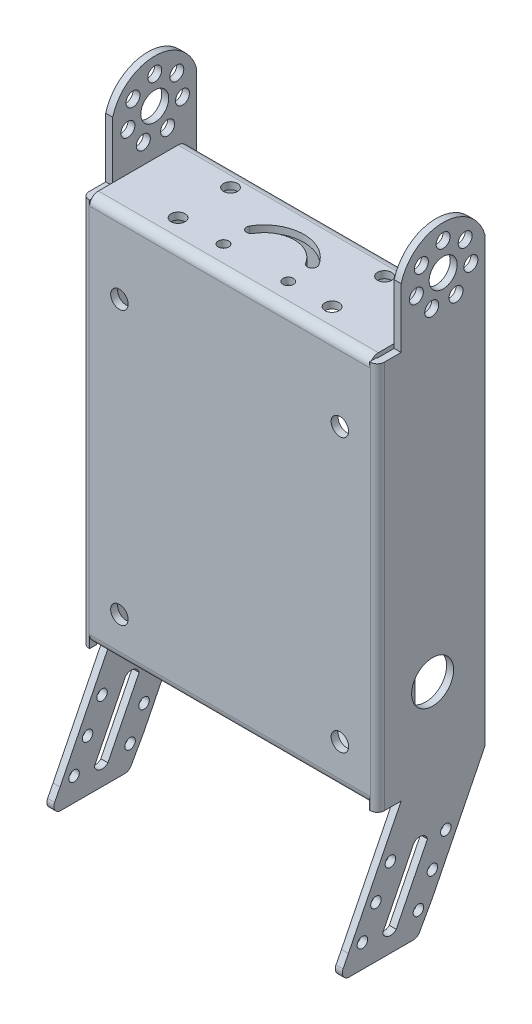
SolidWorks part; units mm, degrees
ref_plane "Plan de face" through (0, 0, 0) normal (0, 0, 1) x (1, 0, 0)
ref_plane "Plan de dessus" through (0, 0, 0) normal (0, 1, 0) x (1, 0, 0)
ref_plane "Plan de droite" through (0, 0, 0) normal (1, 0, 0) x (0, 0, -1)
imported_body "Importée3"
sketch "Esquisse1" plane through (43.375, 0, 0) normal (1, 0, 0) x (0, 0, -1)
  line L0 (6.8004, 103.2822) -> (6.8004, 120.2822)
  line L1 (30.8004, 120.2822) -> (30.8004, -6)
  line L2 (30.8004, -6) -> (15.7419, -36.2027)
  line L3 (15.7419, -36.2027) -> (11.4766, -43.8624)
  line L4 (11.4766, -43.8624) -> (-8.0211, -43.8624)
  line L5 (-9.8033, -40.9548) -> (6.8004, -8.3508)
  line L6 (6.8004, -8.3508) -> (6.8004, -7.7178)
  line L7 (6.8004, -7.7178) -> (0, -7.7178)
  line L8 (0, -7.7178) -> (0, 103.2822)
  line L9 (0, 103.2822) -> (6.8004, 103.2822)
  arc A0 (6.8004, 120.2822) -> (30.8004, 120.2822) centre (18.8004, 117.0095) cw
  arc A1 (-8.0211, -43.8624) -> (-9.8033, -40.9548) centre (-8.0211, -41.8624) cw
extrude "Boss.-Extru.1" add sketch "Esquisse1" along normal blind 2.2
sketch "Esquisse2" plane through (-36.625, 0, 0) normal (-1, 0, 0) x (0, 0, 1)
  line L0 (0, 101.7822) -> (0, 103.2822)
  line L1 (0, 103.2822) -> (-0.5, 103.2822)
  arc A0 (-0.5, 103.2822) -> (0, 101.7822) centre (-2.5, 101.7822) cw
extrude "Enlèv. mat.-Extru.1" cut sketch "Esquisse2" against normal blind 80
sketch "Esquisse3" plane through (43.375, 0, 0) normal (-1, 0, 0) x (0, 0, 1)
  line L0 (-6.8004, -7.7178) -> (-2, -7.7178)
  line L1 (-2, -7.7178) -> (-2, 103.2822)
  line L2 (-2, 103.2822) -> (-6.8004, 103.2822)
  line L3 (-6.8004, 103.2822) -> (-6.8004, 120.2822)
  line L4 (-30.8004, 120.2822) -> (-30.8004, -6)
  line L5 (-30.8004, -6) -> (-15.7419, -36.2027)
  line L6 (-15.7419, -36.2027) -> (-11.4766, -43.8624)
  line L7 (-11.4766, -43.8624) -> (8.0211, -43.8624)
  line L8 (9.8033, -40.9548) -> (-6.8004, -8.3508)
  line L9 (-6.8004, -8.3508) -> (-6.8004, -7.7178)
  arc A0 (-6.8004, 120.2822) -> (-30.8004, 120.2822) centre (-18.8004, 117.0095) ccw
  arc A1 (8.0211, -43.8624) -> (9.8033, -40.9548) centre (8.0211, -41.8624) ccw
extrude "Enlèv. mat.-Extru.2" cut sketch "Esquisse3" against normal blind 0.2
sketch "Esquisse4" plane through (-36.625, 0, 0) normal (-1, 0, 0) x (0, 0, 1)
  line L0 (-2, -7.7178) -> (-2, 103.2822)
  line L1 (-2, 103.2822) -> (0, 103.2822)
  line L2 (0, 103.2822) -> (0, -7.7178)
  line L3 (0, -7.7178) -> (-2, -7.7178)
extrude "Boss.-Extru.2" add sketch "Esquisse4" along normal blind 0.2
sketch "Esquisse5" plane through (-36.825, 0, 0) normal (-1, 0, 0) x (0, 0, 1)
  line L0 (-6.8004, -8.3508) -> (9.8033, -40.9548)
  line L1 (8.0211, -43.8624) -> (-11.4766, -43.8624)
  line L2 (-11.4766, -43.8624) -> (-15.7419, -36.2027)
  line L3 (-15.7419, -36.2027) -> (-30.8004, -6)
  line L4 (-30.8004, -6) -> (-30.8004, 120.2822)
  line L5 (-6.8004, 120.2822) -> (-6.8004, 103.2822)
  line L6 (-6.8004, 103.2822) -> (0, 103.2822)
  line L7 (0, 103.2822) -> (0, -7.7178)
  line L8 (0, -7.7178) -> (-6.8004, -7.7178)
  line L9 (-6.8004, -7.7178) -> (-6.8004, -8.3508)
  arc A0 (9.8033, -40.9548) -> (8.0211, -43.8624) centre (8.0211, -41.8624) cw
  arc A1 (-30.8004, 120.2822) -> (-6.8004, 120.2822) centre (-18.8004, 117.0095) cw
extrude "Boss.-Extru.3" add sketch "Esquisse5" along normal blind 2
sketch "Esquisse6" plane through (0, 0, -24.5) normal (0, 0, -1) x (-1, 0, 0)
  line L0 (21.625, -4.7178) -> (21.625, -6.7178)
  line L1 (21.625, -6.7178) -> (-28.375, -6.7178)
  line L2 (-28.375, -6.7178) -> (-28.375, -4.7178)
  line L3 (-28.375, -4.7178) -> (21.625, -4.7178)
extrude "Boss.-Extru.4" add sketch "Esquisse6" along normal blind 3.5
sketch "Esquisse7" plane through (0, -4.7178, 0) normal (0, 1, 0) x (-1, 0, 0)
  line L0 (-28.375, -26) -> (21.625, -26)
  line L1 (21.625, -26) -> (21.625, -28)
  line L2 (21.625, -28) -> (-28.375, -28)
  line L3 (-28.375, -28) -> (-28.375, -26)
extrude "Boss.-Extru.5" add sketch "Esquisse7" along normal blind 13
sketch "Esquisse8" plane through (0, 102.2822, 0) normal (0, -1, 0) x (1, 0, 0)
  line L0 (-36.625, -26) -> (43.375, -26)
  line L1 (43.375, -26) -> (43.375, -28)
  line L2 (43.375, -28) -> (-36.625, -28)
  line L3 (-36.625, -28) -> (-36.625, -26)
extrude "Boss.-Extru.6" add sketch "Esquisse8" along normal blind 13
sketch "Esquisse9" plane through (43.575, 0, 0) normal (-1, 0, 0) x (0, 0, 1)
  line L0 (-14.3311, -20.8593) -> (-5.4071, -38.758)
  line L1 (-1.526, -37.7903) -> (-10.4499, -19.8916)
  arc A0 (-5.4071, -38.758) -> (-1.526, -37.7903) centre (-3.7419, -37.1698) ccw
  arc A1 (-10.4499, -19.8916) -> (-14.3311, -20.8593) centre (-12.1152, -21.4799) ccw
extrude "Enlèv. mat.-Extru.3" cut sketch "Esquisse9" against normal through all
sketch "Esquisse10" plane through (0, 102.2822, 0) normal (0, -1, 0) x (1, 0, 0)
  arc A0 (-6.3635, -15.468) -> (13.187, -15.6386) centre (3.4623, -9.7638) ccw
  arc A1 (13.187, -15.6386) -> (10.8563, -14.2306) centre (12.0216, -14.9346) ccw
  arc A2 (10.8563, -14.2306) -> (-4.0086, -14.1008) centre (3.4623, -9.7638) cw
  arc A3 (-4.0086, -14.1008) -> (-6.3635, -15.468) centre (-5.1861, -14.7844) ccw
extrude "Enlèv. mat.-Extru.4" cut sketch "Esquisse10" against normal through all
sketch "Esquisse11" plane through (-36.825, 0, 0) normal (1, 0, 0) x (0, 0, -1)
  line L0 (5.4071, -38.758) -> (14.3311, -20.8593)
  line L1 (10.4499, -19.8916) -> (1.526, -37.7903)
  arc A0 (14.3311, -20.8593) -> (10.4499, -19.8916) centre (12.1152, -21.4799) ccw
  arc A1 (1.526, -37.7903) -> (5.4071, -38.758) centre (3.7419, -37.1698) ccw
extrude "Enlèv. mat.-Extru.5" cut sketch "Esquisse11" against normal through all
draft "Dépouille1" type of draft neutral plane draft angle 26.5 faces to draft 1 parameters "D1"=26.5
draft "Dépouille2" type of draft neutral plane draft angle 26.5 faces to draft 1 parameters "D1"=26.5
hole_wizard "Diamètre du perçage Ø5.0 (5)1" positions "Esquisse13" profile "Esquisse12" hole size "Ø5.0" standard "Ansi Metric"
sketch "Esquisse13" plane through (0, 0, 0) normal (0, 0, 1) x (1, 0, 0)
  point P0 (34.874, 83)
  point P1 (-28.124, 83)
  point P2 (34.874, 5)
  point P3 (-28.124, 5)
sketch "Esquisse12" plane through (34.874, 83, 0) normal (1, 0, 0) x (0, -1, 0)
  line L0 (0, 0) -> (0, 30.8004)
  line L1 (0, 30.8004) -> (2.5, 30.8004)
  line L2 (2.5, 30.8004) -> (2.5, 0)
  line L5 (2.5, 0) -> (0, 0)
  line L11 (0, -6.35) -> (0, 107.95) construction
  dimension "Diamètre du perçage jusqu'au prochain" = 5
  dimension "Profondeur du perçage jusqu'au prochain" = 30.8004
hole_wizard "Diamètre du perçage Ø8.0 (8)1" positions "Esquisse15" profile "Esquisse14" hole size "Ø8.0" standard "Ansi Metric"
sketch "Esquisse15" plane through (-38.825, 0, 0) normal (-1, 0, 0) x (0, 0, 1)
  point P0 (-18.8004, 117.0095)
sketch "Esquisse14" plane through (-38.825, 117.0095, -18.8004) normal (0, 1, 0) x (0, 0, 1)
  line L0 (0, 0) -> (0, 2)
  line L1 (0, 2) -> (4, 2)
  line L2 (4, 2) -> (4, 0)
  line L5 (4, 0) -> (0, 0)
  line L11 (0, -6.35) -> (0, 107.95) construction
  dimension "Diamètre du perçage jusqu'au prochain" = 8
  dimension "Profondeur du perçage jusqu'au prochain" = 2
hole_wizard "Diamètre du perçage Ø3.0 (3)1" positions "Esquisse17" profile "Esquisse16" hole size "Ø3.0" standard "Ansi Metric"
sketch "Esquisse17" plane through (-38.825, 0, 0) normal (-1, 0, 0) x (0, 0, 1)
  point P0 (-3.7419, -21.1243)
  point P1 (0.3978, -29.1698)
  point P2 (4.2581, -37.1698)
  point P3 (-11.7419, -37.1698)
  point P4 (-15.7419, -29.1698)
  point P5 (-19.5646, -21.1698)
sketch "Esquisse16" plane through (-38.825, -21.1243, -3.7419) normal (0, 1, 0) x (0, 0, 1)
  line L0 (0, 0) -> (0, 2)
  line L1 (0, 2) -> (1.5, 2)
  line L2 (1.5, 2) -> (1.5, 0)
  line L5 (1.5, 0) -> (0, 0)
  line L11 (0, -6.35) -> (0, 107.95) construction
  dimension "Diamètre du perçage jusqu'au prochain" = 3
  dimension "Profondeur du perçage jusqu'au prochain" = 2
hole_wizard "Diamètre du perçage Ø4.0 (4)1" positions "Esquisse19" profile "Esquisse18" hole size "Ø4.0" standard "Ansi Metric"
sketch "Esquisse19" plane through (-38.825, 0, 0) normal (-1, 0, 0) x (0, 0, 1)
  point P0 (-25.0955, 122.0733)
  point P1 (-26.7323, 115.3269)
  point P2 (-22.4782, 109.8409)
  point P3 (-15.5367, 109.7464)
  point P4 (-11.1349, 115.1146)
  point P5 (-12.5874, 121.9031)
  point P6 (-18.8004, 125)
sketch "Esquisse18" plane through (-38.825, 122.0733, -25.0955) normal (0, 1, 0) x (0, 0, 1)
  line L0 (0, 0) -> (0, 2)
  line L1 (0, 2) -> (2, 2)
  line L2 (2, 2) -> (2, 0)
  line L5 (2, 0) -> (0, 0)
  line L11 (0, -6.35) -> (0, 107.95) construction
  dimension "Diamètre du perçage jusqu'au prochain" = 4
  dimension "Profondeur du perçage jusqu'au prochain" = 2
hole_wizard "Diamètre du perçage Ø12.0 (12)1" positions "Esquisse21" profile "Esquisse20" hole size "Ø12.0" standard "Ansi Metric"
sketch "Esquisse21" plane through (-38.825, 0, 0) normal (-1, 0, 0) x (0, 0, 1)
  point P0 (-15.8004, 17.2822)
sketch "Esquisse20" plane through (-38.825, 17.2822, -15.8004) normal (0, 1, 0) x (0, 0, 1)
  line L0 (0, 0) -> (0, 2)
  line L1 (0, 2) -> (6, 2)
  line L2 (6, 2) -> (6, 0)
  line L5 (6, 0) -> (0, 0)
  line L11 (0, -6.35) -> (0, 107.95) construction
  dimension "Diamètre du perçage jusqu'au prochain" = 12
  dimension "Profondeur du perçage jusqu'au prochain" = 2
hole_wizard "Diamètre du perçage Ø4.0 (4)2" positions "Esquisse23" profile "Esquisse22" hole size "Ø4.0" standard "Ansi Metric"
sketch "Esquisse23" plane through (0, 104.2822, 0) normal (0, 1, 0) x (1, 0, 0)
  point P0 (25.375, 22.2634)
  point P1 (-18.625, 22.2634)
  point P2 (25.375, 7.2634)
  point P3 (-18.625, 7.2634)
sketch "Esquisse22" plane through (25.375, 104.2822, -22.2634) normal (1, 0, 0) x (0, 0, 1)
  line L0 (0, 0) -> (0, 2)
  line L1 (0, 2) -> (2, 2)
  line L2 (2, 2) -> (2, 0)
  line L5 (2, 0) -> (0, 0)
  line L11 (0, -6.35) -> (0, 107.95) construction
  dimension "Diamètre du perçage jusqu'au prochain" = 4
  dimension "Profondeur du perçage jusqu'au prochain" = 2
hole_wizard "Diamètre du perçage Ø3.0 (3)2" positions "Esquisse25" profile "Esquisse24" hole size "Ø3.0" standard "Ansi Metric"
sketch "Esquisse25" plane through (0, 104.2822, 0) normal (0, 1, 0) x (1, 0, 0)
  point P0 (12.8604, 7.2634)
  point P1 (-5.6396, 7.2634)
sketch "Esquisse24" plane through (12.8604, 104.2822, -7.2634) normal (1, 0, 0) x (0, 0, 1)
  line L0 (0, 0) -> (0, 2)
  line L1 (0, 2) -> (1.5, 2)
  line L2 (1.5, 2) -> (1.5, 0)
  line L5 (1.5, 0) -> (0, 0)
  line L11 (0, -6.35) -> (0, 107.95) construction
  dimension "Diamètre du perçage jusqu'au prochain" = 3
  dimension "Profondeur du perçage jusqu'au prochain" = 2
hole_wizard "Diamètre du perçage Ø8.0 (8)2" positions "Esquisse27" profile "Esquisse26" hole size "Ø8.0" standard "Ansi Metric"
sketch "Esquisse27" plane through (45.575, 0, 0) normal (1, 0, 0) x (0, 0, -1)
  point P0 (18.8004, 117.0095)
sketch "Esquisse26" plane through (45.575, 117.0095, -18.8004) normal (0, 1, 0) x (0, 0, -1)
  line L0 (0, 0) -> (0, 84.4)
  line L1 (0, 84.4) -> (4, 84.4)
  line L2 (4, 84.4) -> (4, 0)
  line L5 (4, 0) -> (0, 0)
  line L11 (0, -6.35) -> (0, 107.95) construction
  dimension "Diamètre du perçage jusqu'au prochain" = 8
  dimension "Profondeur du perçage jusqu'au prochain" = 84.4
hole_wizard "Diamètre du perçage Ø4.0 (4)3" positions "Esquisse29" profile "Esquisse28" hole size "Ø4.0" standard "Ansi Metric"
sketch "Esquisse29" plane through (45.575, 0, 0) normal (1, 0, 0) x (0, 0, -1)
  point P0 (25.0955, 122.0733)
  point P1 (18.8004, 125)
  point P2 (26.7323, 115.3269)
  point P3 (22.4782, 109.8409)
  point P4 (15.5367, 109.7464)
  point P5 (11.1349, 115.1146)
  point P6 (12.5874, 121.9031)
sketch "Esquisse28" plane through (45.575, 122.0733, -25.0955) normal (0, 1, 0) x (0, 0, -1)
  line L0 (0, 0) -> (0, 84.4)
  line L1 (0, 84.4) -> (2, 84.4)
  line L2 (2, 84.4) -> (2, 0)
  line L5 (2, 0) -> (0, 0)
  line L11 (0, -6.35) -> (0, 107.95) construction
  dimension "Diamètre du perçage jusqu'au prochain" = 4
  dimension "Profondeur du perçage jusqu'au prochain" = 84.4
hole_wizard "Diamètre du perçage Ø3.0 (3)3" positions "Esquisse31" profile "Esquisse30" hole size "Ø3.0" standard "Ansi Metric"
sketch "Esquisse31" plane through (45.575, 0, 0) normal (1, 0, 0) x (0, 0, -1)
  point P0 (19.5646, -21.1698)
  point P1 (15.7419, -29.1698)
  point P2 (3.7419, -21.1243)
  point P3 (-0.3978, -29.1698)
  point P4 (11.7419, -37.1698)
  point P5 (-4.2581, -37.1698)
sketch "Esquisse30" plane through (45.575, -21.1698, -19.5646) normal (0, 1, 0) x (0, 0, -1)
  line L0 (0, 0) -> (0, 84.4)
  line L1 (0, 84.4) -> (1.5, 84.4)
  line L2 (1.5, 84.4) -> (1.5, 0)
  line L5 (1.5, 0) -> (0, 0)
  line L11 (0, -6.35) -> (0, 107.95) construction
  dimension "Diamètre du perçage jusqu'au prochain" = 3
  dimension "Profondeur du perçage jusqu'au prochain" = 84.4
hole_wizard "Diamètre du perçage Ø12.0 (12)2" positions "Esquisse33" profile "Esquisse32" hole size "Ø12.0" standard "Ansi Metric"
sketch "Esquisse33" plane through (45.575, 0, 0) normal (1, 0, 0) x (0, 0, -1)
  point P0 (15.8004, 17.2822)
sketch "Esquisse32" plane through (45.575, 17.2822, -15.8004) normal (0, 1, 0) x (0, 0, -1)
  line L0 (0, 0) -> (0, 84.4)
  line L1 (0, 84.4) -> (6, 84.4)
  line L2 (6, 84.4) -> (6, 0)
  line L5 (6, 0) -> (0, 0)
  line L11 (0, -6.35) -> (0, 107.95) construction
  dimension "Diamètre du perçage jusqu'au prochain" = 12
  dimension "Profondeur du perçage jusqu'au prochain" = 84.4
hole_wizard "Diamètre du perçage Ø3.0 (3)4" positions "Esquisse35" profile "Esquisse34" hole size "Ø3.0" standard "Ansi Metric"
sketch "Esquisse35" plane through (0, 0, -28) normal (0, 0, -1) x (-1, 0, 0)
  point P0 (10.625, 95.2822)
  point P1 (26.625, 95.2822)
  point P2 (-17.375, 95.2822)
  point P3 (-33.375, 95.2822)
  point P4 (-13.375, 0.2822)
  point P5 (6.625, 0.2822)
sketch "Esquisse34" plane through (-10.625, 95.2822, -28) normal (1, 0, 0) x (0, 1, 0)
  line L0 (0, 0) -> (0, 2)
  line L1 (0, 2) -> (1.5, 2)
  line L2 (1.5, 2) -> (1.5, 0)
  line L5 (1.5, 0) -> (0, 0)
  line L11 (0, -6.35) -> (0, 107.95) construction
  dimension "Diamètre du perçage jusqu'au prochain" = 3
  dimension "Profondeur du perçage jusqu'au prochain" = 2
fillet "Congé1" radius 0.001 2 edges at (43.575, 47.7822, -2)
fillet "Congé2" radius 0.5 5 edges at (3.375, -4.7178, -26) (43.375, -4.7178, -2.25)
fillet "Congé3" radius 0.7366 1 edges at (3.375, 102.2822, -26)
fillet "Congé4" radius 2 4 edges at (45.575, 47.7822, 0) (44.575, -43.8624, -11.4766) (-38.825, 47.7822, 0) (-37.825, -43.8624, -11.4766)
fillet "Congé5" radius 2.5 2 edges at (3.375, -6.7178, -28)
fillet "Congé6" radius 2.7366 1 edges at (3.375, 104.2822, -28)
fillet "Congé7" radius 3 4 edges at (-21.625, 8.2822, -27) (43.375, 89.2822, -27) (-36.625, 89.2822, -27) (28.375, 8.2822, -27)
